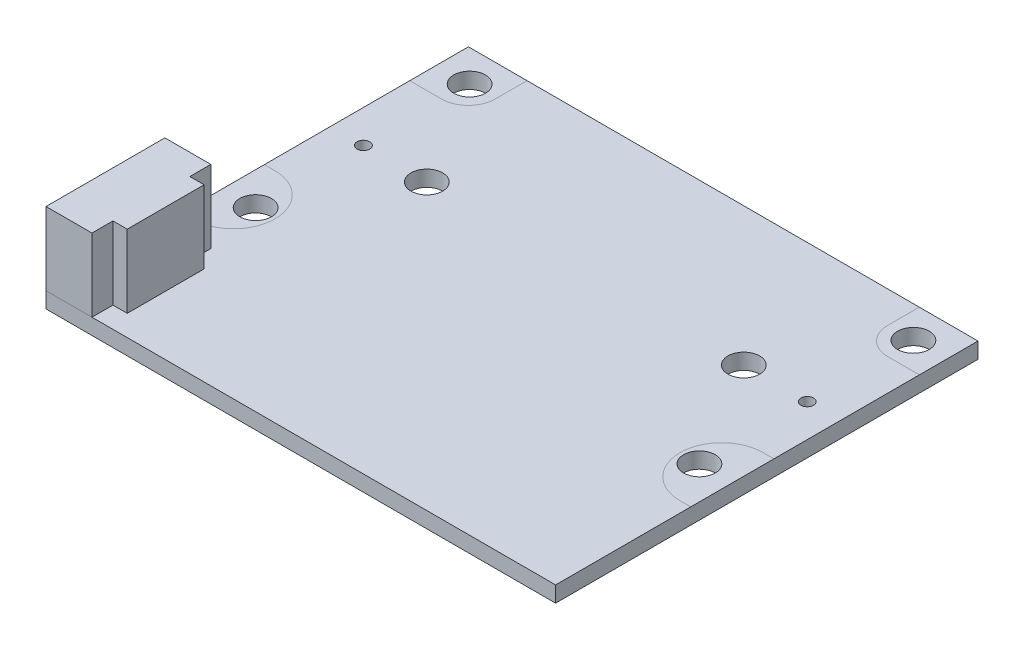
SolidWorks part; units mm, degrees
ref_plane "Front" through (0, 0, 0) normal (0, 0, 1) x (1, 0, 0)
ref_plane "Top" through (0, 0, 0) normal (0, 1, 0) x (1, 0, 0)
ref_plane "Right" through (0, 0, 0) normal (1, 0, 0) x (0, 0, -1)
sketch "Sketch1" plane through (0, 0, 0) normal (0, 1, 0) x (1, 0, 0)
  line L0 (0, 0) -> (0, 16268.1919) construction
  line L1 (0, 0) -> (16268.1919, 0) construction
  line L3 (-16.075, -17.95) -> (16.075, -17.95)
  line L4 (-16.075, -17.95) -> (-16.075, 8.7)
  line L5 (-16.075, 8.7) -> (16.075, 8.7)
  line L6 (16.075, -17.95) -> (16.075, 8.7)
  circle A0 centre (14, 6.7) radius 1
  circle A1 centre (14, -6.8) radius 1
  circle A2 centre (14, 0) radius 0.4
  circle A3 centre (10, 0) radius 1
  circle A4 centre (-14, 0) radius 0.4
  circle A5 centre (-14, -6.8) radius 1
  circle A6 centre (-14, 6.7) radius 1
  circle A7 centre (-10, 0) radius 1
  point P17 (0, 0)
  point P18 (0, 0)
  dimension "D4" = 0.8
  dimension "D5" = 2
  dimension "D6" = 13.5
  dimension "D7" = 28
  dimension "D8" = 2
  dimension "D9" = 2
  dimension "D10" = 20
  dimension "D1" = 26.65
  dimension "D2" = 32.15
  dimension "D3" = 8.7
extrude "Boss-Extrude1" add sketch "Sketch1" along normal blind 1
sketch "Sketch4" plane through (0, 1, 0) normal (0, 1, 0) x (1, 0, 0)
  line L0 (16.075, 5) -> (14.075, 5)
  line L1 (16.075, 8.7) -> (-16.075, 8.7) construction
  line L2 (16.075, -17.95) -> (16.075, 8.7) construction
  line L3 (16.075, 5) -> (16.075, 8.7)
  line L4 (16.075, 8.7) -> (12.375, 8.7)
  line L5 (16.075, -9.425) -> (16.075, -4.175)
  line L6 (0, -0.1285) -> (0, -50000.1285) construction
  line L7 (14, -6.8) -> (-49986, -6.8) construction
  line L8 (14, 6.7) -> (-49986, 6.7) construction
  line L9 (12.375, 8.7) -> (12.375, 6.7)
  line L10 (16.075, -4.175) -> (15.4, -4.175)
  line L11 (16.075, -9.425) -> (15.4, -9.425)
  line L12 (-16.075, -9.425) -> (-15.4, -9.425)
  line L13 (-16.075, -4.175) -> (-15.4, -4.175)
  line L14 (-12.375, 8.7) -> (-12.375, 6.7)
  line L15 (-16.075, -9.425) -> (-16.075, -4.175)
  line L16 (-16.075, 8.7) -> (-12.375, 8.7)
  line L17 (-16.075, 5) -> (-16.075, 8.7)
  line L18 (-16.075, 5) -> (-14.075, 5)
  arc A2 (12.375, 6.7) -> (14.075, 5) centre (14.075, 6.7) ccw
  arc A3 (15.4, -4.175) -> (15.4, -9.425) centre (15.4, -6.8) ccw
  arc A4 (-15.4, -4.175) -> (-15.4, -9.425) centre (-15.4, -6.8) cw
  arc A5 (-12.375, 6.7) -> (-14.075, 5) centre (-14.075, 6.7) cw
  dimension "D1" = 5.25
  dimension "D3" = 3.3
  dimension "D2" = 3.7
sketch "Sketch5" plane through (0, 1, 0) normal (0, 1, 0) x (1, 0, 0)
  line L0 (-16.075, -14.2) -> (49983.925, -14.2) construction
  line L1 (-16.075, -17.95) -> (-13.175, -17.95)
  line L2 (-16.075, -17.95) -> (-16.075, -10.45)
  line L3 (-16.075, -10.45) -> (-13.175, -10.45)
  line L4 (-13.175, -17.95) -> (-13.175, -16.625)
  line L5 (-13.175, -16.625) -> (-12.275, -16.625)
  line L7 (-13.175, -11.775) -> (-12.275, -11.775)
  line L8 (-12.275, -16.625) -> (-12.275, -11.775)
  line L9 (-13.175, -11.775) -> (-13.175, -10.45)
  point P11 (-16.075, -14.2)
  dimension "D1" = 7.5
  dimension "D2" = 3.8
  dimension "D3" = 2.9
  dimension "D4" = 4.85
extrude "Boss-Extrude3" add sketch "Sketch5" along normal blind 4.6 separate body
ref_point "Point1"
